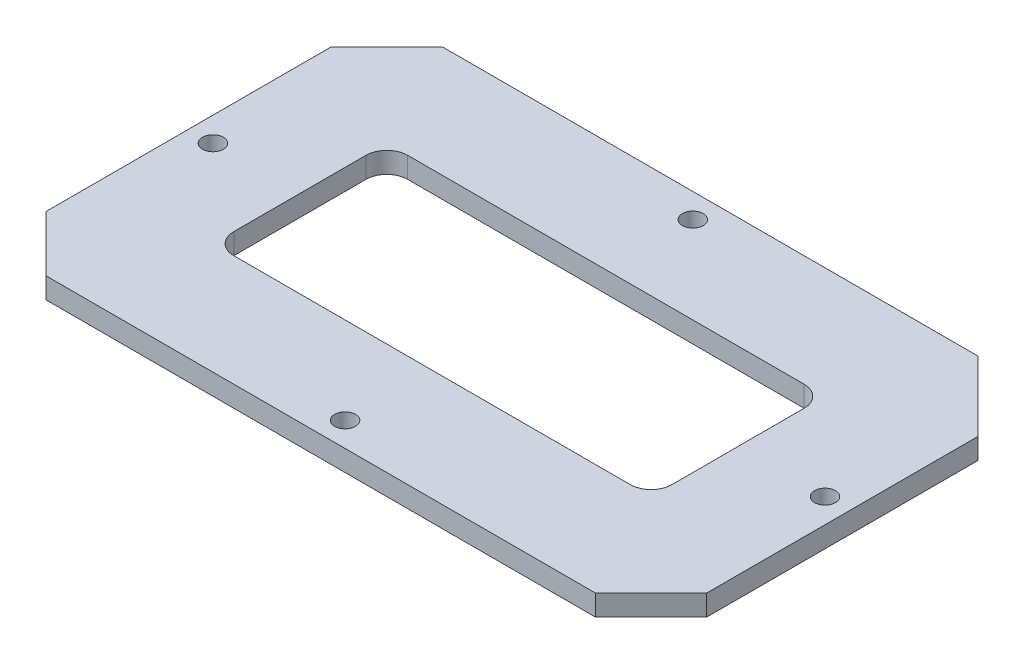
SolidWorks part; units mm, degrees
ref_plane "Ebene vorne" through (0, 0, 0) normal (0, 0, 1) x (1, 0, 0)
ref_plane "Ebene oben" through (0, 0, 0) normal (0, 1, 0) x (1, 0, 0)
ref_plane "Ebene rechts" through (0, 0, 0) normal (1, 0, 0) x (0, 0, -1)
sketch "Skizze1" plane through (0, 0, 0) normal (0, 1, 0) x (1, 0, 0)
  line L0 (-97.6104, 0) -> (96.3111, 0) construction
  line L1 (0, 57.3319) -> (0, -62.2043) construction
  line L2 (37.5, 28.5) -> (47.5, 18.5)
  line L3 (-39.5, 28.5) -> (37.5, 28.5)
  line L4 (-47.5, 20.5) -> (-47.5, -20.5)
  line L5 (-39.5, -28.5) -> (39.5, -28.5)
  line L6 (47.5, 18.5) -> (47.5, -20.5)
  line L7 (39.5, -28.5) -> (47.5, -20.5)
  line L8 (-47.5, -20.5) -> (-39.5, -28.5)
  line L9 (-47.5, 20.5) -> (-39.5, 28.5)
  line L11 (-28.5, 12.5) -> (28.5, 12.5)
  line L12 (-31.5, 9.5) -> (-31.5, -9.5)
  line L13 (-28.5, -12.5) -> (28.5, -12.5)
  line L14 (31.5, 9.5) -> (31.5, -9.5)
  arc A0 (-28.5, 12.5) -> (-31.5, 9.5) centre (-28.5, 9.5) ccw
  arc A1 (-31.5, -9.5) -> (-28.5, -12.5) centre (-28.5, -9.5) ccw
  arc A2 (28.5, -12.5) -> (31.5, -9.5) centre (28.5, -9.5) ccw
  arc A3 (28.5, 12.5) -> (31.5, 9.5) centre (28.5, 9.5) cw
  circle A4 centre (0, 25) radius 1.5
  circle A5 centre (0, -25) radius 1.5
  circle A6 centre (-44, 0) radius 1.5
  circle A7 centre (44, 0) radius 1.5
  point P5 (-47.5, 28.5)
  point P6 (47.5, -28.5)
  point P7 (-47.5, -28.5)
  point P8 (47.5, 28.5)
  point P23 (-31.5, 12.5)
  point P28 (31.5, -12.5)
  point P31 (31.5, 12.5)
  dimension "D9" = 3
  dimension "D10" = 3
  dimension "D12" = 3
  dimension "D1" = 95
  dimension "D2" = 57
  dimension "D3" = 63
  dimension "D4" = 25
  dimension "D11" = 3.5
  dimension "D13" = 3.5
extrude "Aufsatz-Linear austragen1" add sketch "Skizze1" along normal blind 3
sketch "Skizze2" plane through (33, 0, -33) normal (0.7071, 0, -0.7071) x (-0.7071, 0, -0.7071)
  line L0 (-20.5061, 1.5) -> (-6.364, 1.5) construction
  line L1 (-20.5061, 3) -> (-20.5061, 0) construction
  line L2 (-6.364, 3) -> (-6.364, 0) construction
  circle A0 centre (-13.435, 1.5) radius 1
  dimension "D1" = 2
